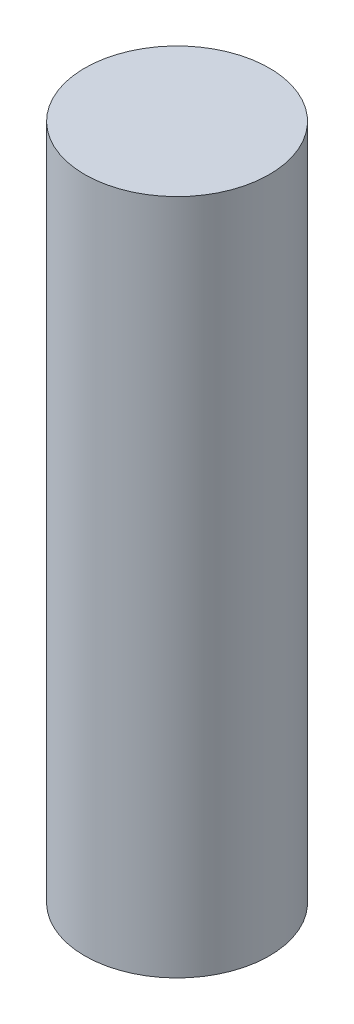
SolidWorks part; units mm, degrees
ref_plane "Front Plane" through (0, 0, 0) normal (0, 0, 1) x (1, 0, 0)
ref_plane "Top Plane" through (0, 0, 0) normal (0, 1, 0) x (1, 0, 0)
ref_plane "Right Plane" through (0, 0, 0) normal (1, 0, 0) x (0, 0, -1)
sketch "Sketch1" plane through (0, 0, 0) normal (0, 1, 0) x (1, 0, 0)
  circle A0 centre (0, 0) radius 4.7625
  dimension "D1" = 9.525
extrude "Boss-Extrude1" add sketch "Sketch1" along normal blind 34.925
